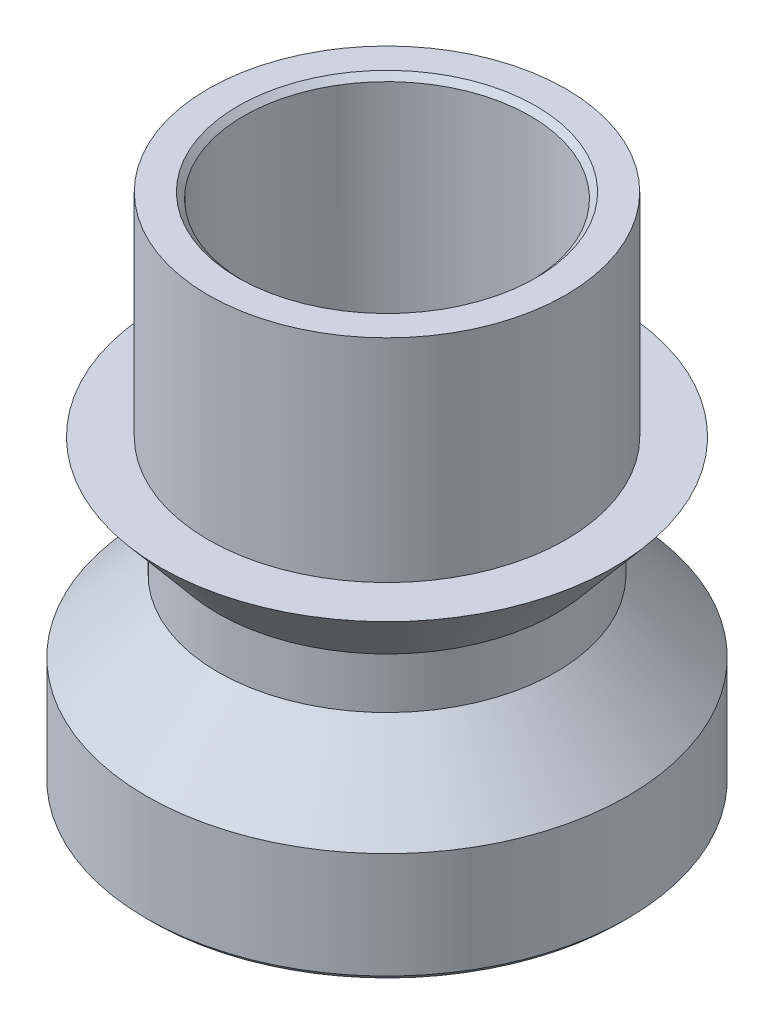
SolidWorks part; units mm, degrees
ref_plane "Front Plane" through (0, 0, 0) normal (0, 0, 1) x (1, 0, 0)
ref_plane "Top Plane" through (0, 0, 0) normal (0, 1, 0) x (1, 0, 0)
ref_plane "Right Plane" through (0, 0, 0) normal (1, 0, 0) x (0, 0, -1)
sketch "Sketch1" plane through (0, 0, 0) normal (0, 1, 0) x (1, 0, 0)
  circle A0 centre (0, 0) radius 10.668
  circle A1 centre (0, 0) radius 6.35
extrude "Boss-Extrude2" add sketch "Sketch1" along normal blind 3.048
sketch "Sketch2" plane through (0, 3.048, 0) normal (0, 1, 0) x (1, 0, 0)
  circle A0 centre (0, 0) radius 7.9248
  circle A1 centre (0, 0) radius 6.35
extrude "Boss-Extrude3" add sketch "Sketch2" along normal blind 9.398
chamfer "Chamfer1" distance 3.175 angle 50 1 edges at (0, 0, 10.668)
sketch "Sketch3" plane through (0, 0, 0) normal (0, -1, 0) x (1, 0, 0)
  circle A0 centre (0, 0) radius 6.35
  circle A1 centre (0, 0) radius 7.493
extrude "Boss-Extrude4" add sketch "Sketch3" along normal blind 2.2479
sketch "Sketch4" plane through (0, -2.2479, 0) normal (0, -1, 0) x (1, 0, 0)
  circle A0 centre (0, 0) radius 6.35
  circle A1 centre (0, 0) radius 10.668
extrude "Boss-Extrude5" add sketch "Sketch4" along normal blind 8.128
chamfer "Chamfer2" distance 3.175 angle 45 1 edges at (0, -2.2479, -10.668)
chamfer "Chamfer3" distance 0.254 angle 45 3 edges at (0, 12.446, 6.35) (0, -10.3759, -6.35) (0, -10.3759, -10.668)
